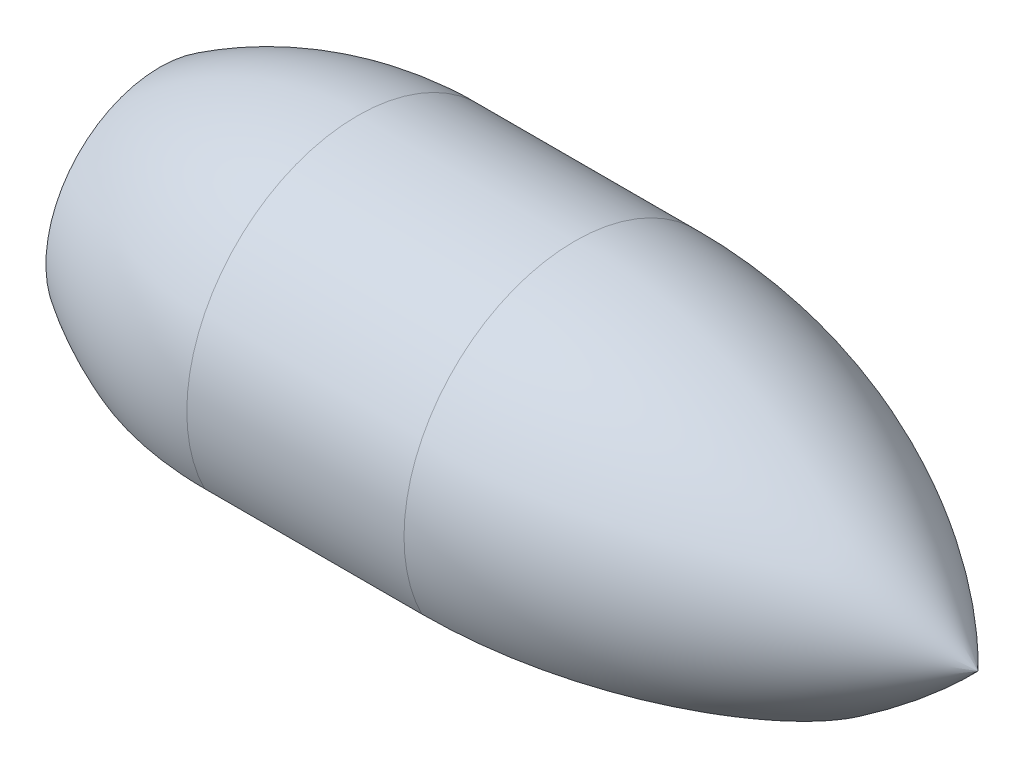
SolidWorks part; units mm, degrees
ref_plane "Front Plane" through (0, 0, 0) normal (0, 0, 1) x (1, 0, 0)
ref_plane "Top Plane" through (0, 0, 0) normal (0, 1, 0) x (1, 0, 0)
ref_plane "Right Plane" through (0, 0, 0) normal (1, 0, 0) x (0, 0, -1)
sketch "Sketch2" plane through (0, 0, 0) normal (1, 0, 0) x (0, 0, -1)
  circle A0 centre (0, 0) radius 18.288
  dimension "D1" = 36.576
extrude "Extrude1" add sketch "Sketch2" along normal blind 87.63
sketch "Sketch3" plane through (0, 0, 0) normal (0, 0, 1) x (1, 0, 0)
  line L0 (87.63, -18.288) -> (87.63, 18.288) construction
  line L2 (44.45, 0) -> (44.45, 18.288) construction
  line L3 (87.63, 18.288) -> (0, 18.288) construction
  line L4 (87.63, 0.0088) -> (87.63, 18.288)
  line L5 (87.63, 18.288) -> (44.45, 18.288)
  line L6 (0, 0) -> (21.1849, 0) construction
  line L7 (21.1849, 0) -> (21.1849, 18.288) construction
  line L8 (0, 0) -> (0, 12.192) construction
  line L9 (0, 18.288) -> (0, -18.288) construction
  line L10 (21.1849, 18.288) -> (0, 18.288)
  line L11 (0, 18.288) -> (0, 12.192)
  arc A0 (44.45, 18.288) -> (87.63, 0.0088) centre (44.45, -41.8525) cw
  arc A1 (21.1849, 18.288) -> (0, 12.192) centre (21.1849, -21.5709) ccw
  dimension "D1" = 12.192
revolve "shape" cut sketch "Sketch3" angle 360 about L6
sketch "Sketch5" plane through (0, 0, 0) normal (-1, 0, 0) x (0, 0, 1)
  circle A0 centre (0, 0) radius 7.9375
  dimension "D1" = 15.875
extrude "Cut-Extrude2" cut sketch "Sketch5" against normal blind 24.13
sketch "Sketch4" plane through (0, 0, 0) normal (-1, 0, 0) x (0, 0, 1)
  line L0 (0, -20.6375) -> (0, 0) construction
  line L1 (16.3949, -8.103) -> (-16.3949, -8.103)
  line L2 (0, -20.6375) -> (16.3949, -8.103) construction
  line L3 (16.3949, -8.103) -> (16.3949, -20.6375)
  line L4 (16.3949, -20.6375) -> (-16.3949, -20.6375)
  line L5 (-16.3949, -20.6375) -> (-16.3949, -8.103)
  circle A1 centre (0, 0) radius 18.288 construction
  dimension "D1" = 20.6375
  dimension "D2" = 20.6375
extrude "Cut-Extrude1" cut sketch "Sketch4" against normal through all
sketch "Sketch8" plane through (0, 0, 0) normal (0, 1, 0) x (1, 0, 0)
  line L0 (26.2128, 3.2946) -> (26.2128, 11.8036)
  line L1 (26.2128, 3.2946) -> (34.4678, 3.2946)
  line L2 (18.923, 11.8036) -> (26.2128, 11.8036)
  line L3 (26.2128, -3.3094) -> (34.4678, -3.3094)
  line L4 (18.923, 11.8036) -> (18.923, -11.8184)
  line L5 (18.923, -11.8184) -> (26.2128, -11.8184)
  line L6 (26.2128, -11.8184) -> (26.2128, -3.3094)
  line L7 (34.4678, 11.8036) -> (42.3418, 11.8036)
  line L8 (34.4678, -11.8184) -> (34.4678, -3.3094)
  line L9 (34.4678, -11.8184) -> (42.3418, -11.8184)
  line L10 (42.3418, 11.8036) -> (42.3418, -11.8184)
  line L11 (34.4678, 3.2946) -> (34.4678, 11.8036)
  line L12 (42.3418, -0.0074) -> (18.923, -0.0074) construction
  line L13 (0, 0) -> (92.1788, -0.0362) construction
  line L14 (0, 12.192) -> (0, -12.192) construction
  line L15 (26.2128, 3.2946) -> (26.2128, -3.3094) construction
  point P20 (26.2128, -0.0074)
  dimension "D1" = 7.2898
  dimension "D2" = 7.874
  dimension "D3" = 8.255
  dimension "D4" = 18.923
  dimension "D5" = 23.622
  dimension "D6" = 6.604
extrude "camera base and transmitter" cut sketch "Sketch8" along normal blind 12.954 and the other way through all
fillet "Fillet1" radius 1.5875
sketch "r" plane through (0, 0, 0) normal (0, 1, 0) x (1, 0, 0)
  line L1 (65.7098, -0.0074) -> (42.3418, -0.0074) construction
  line L2 (42.3418, 3.1676) -> (42.3418, -3.1824)
  line L3 (42.3418, -3.1824) -> (65.7098, -3.1824)
  line L4 (65.7098, 3.1676) -> (65.7098, -3.1824)
  line L5 (42.3418, 3.1676) -> (65.7098, 3.1676)
  line L6 (42.3418, -10.2309) -> (42.3418, 10.2161) construction
  line L7 (42.3418, -10.2309) -> (42.3418, 10.2161) construction
  dimension "D1" = 6.35
  dimension "D2" = 23.368
extrude "tab slot" cut sketch "r" along normal blind 10.16 and the other way through all
sketch "Sketch9" plane through (18.923, 0, 0) normal (1, 0, 0) x (0, 0, -1)
  line L1 (-7.874, 7.874) -> (7.874, 7.874)
  line L2 (-7.874, 7.874) -> (-7.874, -2.6762)
  line L3 (-7.874, -2.6762) -> (7.874, -2.6762)
  line L4 (7.874, 7.874) -> (7.874, -2.6762)
extrude "Cut-Extrude6" cut sketch "Sketch9" against normal blind 5.588
sketch "Sketch10" plane through (0, 0, 0) normal (0, 1, 0) x (1, 0, 0)
  line L0 (0, 12.192) -> (0, -12.192) construction
  line L1 (0, -12.7042) -> (10.9133, -12.7042)
  line L2 (0, -12.7042) -> (0, 12.8228)
  line L3 (0, 12.8228) -> (10.9133, 12.8228)
  line L4 (10.9133, -12.7042) -> (10.9133, -7.874)
  line L5 (15.1084, 0.0593) -> (0, 0.0593) construction
  line L6 (18.923, 10.2161) -> (18.923, -10.2309) construction
  line L7 (10.9133, -7.874) -> (18.923, -7.874)
  line L8 (18.923, -7.874) -> (18.923, 7.874)
  line L9 (18.923, 7.874) -> (10.9133, 7.874)
  line L11 (10.9133, 7.874) -> (10.9133, 12.8228)
  line L12 (10.9133, -7.874) -> (10.9133, 7.874) construction
  dimension "D1" = 25.527
extrude "holder interface" cut sketch "Sketch10" against normal through all
sketch "Sketch11" plane through (0, 0, 0) normal (0, 0, 1) x (1, 0, 0)
  line L0 (0, 12.192) -> (0, 0) construction
  line L1 (0, -7.3177) -> (4.572, -7.3177)
  line L2 (0, -7.3177) -> (0, 0)
  line L3 (0, 0) -> (4.572, 0)
  line L4 (4.572, -7.3177) -> (4.572, 0)
  line L5 (0.8391, 0) -> (10.9133, 0) construction
  point P6 (0.8391, 0)
  point P7 (5.491, -8.103)
  dimension "D1" = 4.572
extrude "Cut-Extrude8" cut sketch "Sketch11" against normal through all and the other way through all
fillet "Fillet2" radius 3.175
fillet "Fillet3" radius 3.175
sketch "Sketch13" plane through (0, 12.954, 0) normal (0, -1, 0) x (1, 0, 0)
  line L3 (26.2128, 3.3094) -> (26.2128, -3.2946) construction
  line L4 (34.4678, 3.3094) -> (34.4678, -3.2946) construction
  line L5 (34.4678, 0.0074) -> (26.2128, 0.0074) construction
sketch "Sketch14" plane through (0, 10.16, 0) normal (0, -1, 0) x (1, 0, 0)
  line L0 (65.7098, 0.0074) -> (34.4678, 0.0074) construction
  line L1 (34.4678, -10.2161) -> (34.4678, -3.2946) construction
  line L2 (34.4678, 3.3094) -> (34.4678, -3.2946) construction
hole_wizard "#4 Clearance Hole1" positions "3DSketch1" profile "Sketch12" hole size "#4" standard "Ansi Inch"
sketch3d "3DSketch1"
  line L1 (65.7098, 10.16, 0.0074) -> (34.4678, 10.16, 0.0074) construction
  line L2 (34.4678, 12.954, 0.0074) -> (26.2128, 12.954, 0.0074) construction
  point P0 (30.3403, 12.954, 0.0074)
  point P2 (47.3583, 10.16, 0.0074)
  point P4 (57.5183, 10.16, 0.0074)
  dimension "D1" = 10.16
  dimension "D2" = 12.8905
sketch "Sketch12" plane through (30.3403, 12.954, 0.0074) normal (1, 0, 0) x (0, 0, -1)
  line L0 (0, 0) -> (0, 5.334)
  line L1 (0, 5.334) -> (1.4732, 5.334)
  line L2 (1.4732, 5.334) -> (1.4732, 0)
  line L5 (1.4732, 0) -> (0, 0)
  line L11 (0, -6.35) -> (0, 107.95) construction
  dimension "Thru Hole Dia." = 2.9464
  dimension "Thru Hole Depth" = 5.334
fillet "Fillet4" radius 2.54
sketch "Sketch15" plane through (0, -8.103, 0) normal (0, -1, 0) x (1, 0, 0)
  circle A0 centre (38.792, 0.0074) radius 4.7625
  dimension "D1" = 9.525
extrude "Cut-Extrude9" cut sketch "Sketch15" against normal offset from surface (22.835 mm away) 1.778
